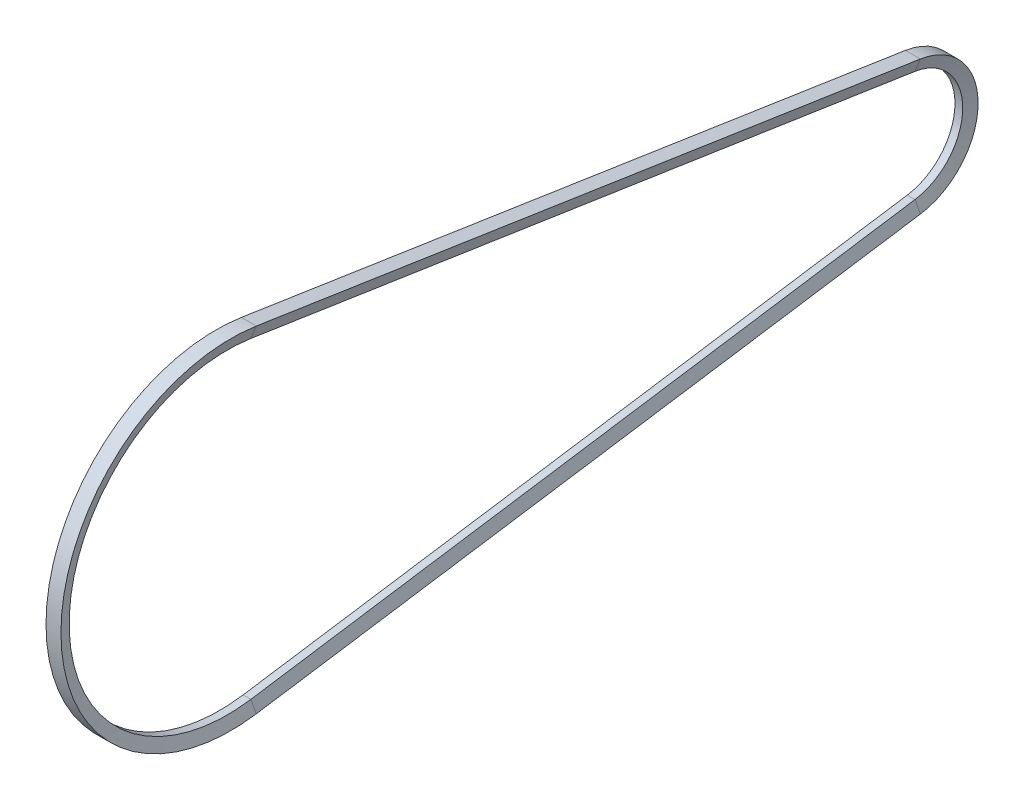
SolidWorks part; units mm, degrees
ref_plane "前视基准面" through (0, 0, 0) normal (0, 0, 1) x (1, 0, 0)
ref_plane "上视基准面" through (0, 0, 0) normal (0, 1, 0) x (1, 0, 0)
ref_plane "右视基准面" through (0, 0, 0) normal (1, 0, 0) x (0, 0, -1)
sketch "草图1" plane through (0, 0, 0) normal (1, 0, 0) x (0, 0, -1)
  line L0 (18.75, 123.5857) -> (507.5, 49.4343)
  line L1 (18.75, -123.5857) -> (507.5, -49.4343)
  line L2 (0, 0) -> (500, 0) construction
  arc A0 (18.75, 123.5857) -> (18.75, -123.5857) centre (0, 0) ccw
  arc A1 (507.5, -49.4343) -> (507.5, 49.4343) centre (500, 0) ccw
  dimension "D1" = 125
  dimension "D2" = 50
  dimension "D3" = 500
sketch "草图2" plane through (0, 0, 0) normal (0, 0, 1) x (1, 0, 0)
  line L0 (-5.5, 125) -> (5.5, 125)
  line L1 (5.5, 125) -> (2.8401, 116.3)
  line L2 (2.8401, 116.3) -> (-2.8401, 116.3)
  line L3 (-2.8401, 116.3) -> (-5.5, 125)
  line L4 (0, 116.3) -> (0, 125) construction
  line L5 (0, -125) -> (0, 125) construction
  dimension "D1" = 11
  dimension "D2" = 8.7
  dimension "D3" = 34
sweep "扫描1" add profiles "草图2" path "草图1"
equation "\"D3@草图1\" = \"D1@距离1@实心轮_实心轮.Assembly\""
equation "\"D3@草图1\" = \"D1@距离1@实心轮_孔板轮.Assembly\""
equation "\"D3@草图1\" = \"D1@距离1@实心轮_辐板轮.Assembly\""
equation "\"D3@草图1\" = \"D1@距离1@孔板轮_孔板轮.Assembly\""
equation "\"D3@草图1\" = \"D1@距离1@孔板轮_辐板轮.Assembly\""
equation "\"D3@草图1\" = \"D1@距离1@辐板轮_辐板轮.Assembly\""
equation "\"D1@草图2\" = \"bd@草图1@小带轮_实心轮.Part\" "
equation "\"D1@草图2\" = \"bd@草图1@大带轮_孔板轮.Part\" "
equation "\"D1@草图2\" = \"bd@草图1@大带轮_辐板轮.Part\" "
equation "\"D2@草图2\" = \"hf@草图1@小带轮_实心轮.Part\" "
equation "\"D2@草图2\" = \"hf@草图1@大带轮_辐板轮.Part\" "
equation "\"D2@草图2\" = \"hf@草图1@大带轮_孔板轮.Part\" "
equation "\"D3@草图2\" = \"槽轮角@草图1@小带轮_实心轮.Part\" "
equation "\"D3@草图2\" = \"槽轮角@草图1@大带轮_辐板轮.Part\" "
equation "\"D3@草图2\" = \"槽轮角@草图1@大带轮_孔板轮.Part\" "
equation "\"D2@草图1\" = \"dd@草图1@小带轮_实心轮.Part\"/2"
equation " \"D2@草图1\" = \"dd@草图1@小带轮_孔板轮.Part\"/2"
equation "\"D2@草图1\" = \"dd@草图1@小带轮_辐板轮.Part\"/2  "
equation "\"D1@草图1\" = \"dd@草图1@大带轮_实心轮.Part\" /2"
equation "\"D1@草图1\" = \"dd@草图1@大带轮_孔板轮.Part\" /2"
equation "\"D1@草图1\" = \"dd@草图1@大带轮_辐板轮.Part\" /2"
